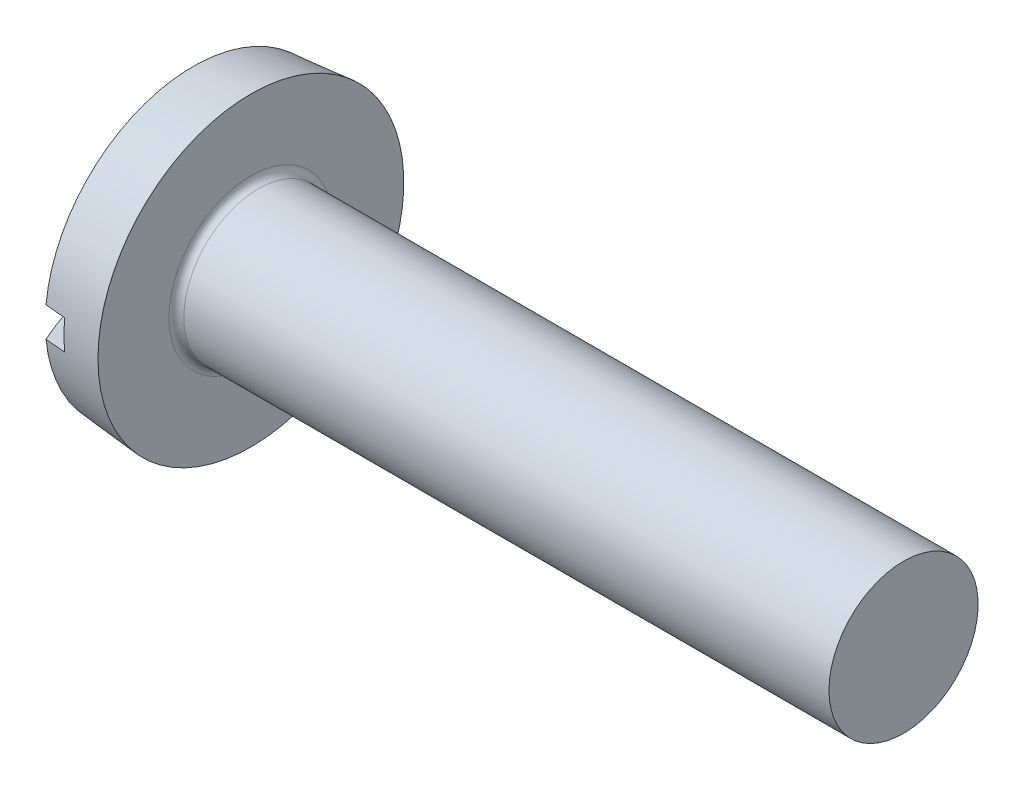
SolidWorks part; units mm, degrees
ref_plane "Plane1" through (0, 0, 0) normal (0, 0, 1) x (1, 0, 0)
ref_plane "Plane2" through (0, 0, 0) normal (0, 1, 0) x (1, 0, 0)
ref_plane "Plane3" through (0, 0, 0) normal (1, 0, 0) x (0, 0, -1)
other "Configuration Table"
sketch "BodySke" plane through (0, 0, 0) normal (0, 0, 1) x (1, 0, 0)
  line L0 (4.8, 4) -> (4.8, 8.2)
  line L1 (4.8, 8.2) -> (4.79, 8.2)
  line L2 (-25.4, 0) -> (127, 0) construction
  line L4 (4.8, 4) -> (39.8, 4)
  line L5 (39.8, 4) -> (39.8, 0)
  line L6 (39.8, 0) -> (0, 0)
  line L7 (4.8, -4) -> (39.8, -4) construction
  line L8 (6.05, 6.35) -> (6.05, -3.175) construction
  line L9 (9.8, 6.35) -> (9.8, -3.175) construction
  line L10 (4.79, 8.2) -> (1.7, 7.9297)
  arc A0 (0, 0) -> (1.7, 7.9297) centre (19.344, 0) cw
revolve "Base-Revolve" add sketch "BodySke"
fillet "Fillet1" radius 0.4 1 edges at (4.8, 0, 4)
sketch "Sketch2" plane through (0, 0, 0) normal (1, 0, 0) x (0, 0, -1)
  line L0 (8.2, -0.8) -> (8.2, 0.8)
  line L1 (8.2, 0.8) -> (-8.2, 0.8)
  line L2 (-8.2, 0.8) -> (-8.2, -0.8)
  line L3 (-8.2, -0.8) -> (8.2, -0.8)
extrude "Slot" cut sketch "Sketch2" along normal blind 2.8
sketch "ThdSchSke" plane through (0, 0, 0) normal (0, 0, 1) x (1, 0, 0)
  line L0 (9.8, -3.3095) -> (9.3165, -4)
  line L1 (9.8, -3.3095) -> (10.2835, -4)
  line L2 (10.2835, -4) -> (10.2835, -5)
  line L3 (-3.175, 0) -> (5.1513, 0) construction
  line L5 (10.2835, -5) -> (9.3165, -5)
  line L6 (9.3165, -5) -> (9.3165, -4)
revolve "ThreadSchematic" [suppressed] cut sketch "ThdSchSke" angle 360 about L3
pattern_linear "ThdSchPat" [suppressed]
equation "' \"Diameter@BodySke\" = 8"
equation "' \"Length@BodySke\" = 35"
equation "' \"Head_dia@BodySke\" = 16.4"
equation "' \"Oval_ht@BodySke\" = 1.7"
equation "' \"Head_ht@BodySke\" = 4.8"
equation "' \"Thread_nom@BodySke\" =  30"
equation "' \"Thread_nom@BodySke\" = 30"
equation "' \"Head_ang@BodySke\" = 85"
equation "' \"Slot_width@Sketch2\" = 1.6"
equation "' \"Slot_depth@Slot\" = 2.8"
equation "' \"Thread_minor@ThreadCosmetic\" = 6.619"
equation "' \"Advance@BodySke\" = 1.25"
equation "\"D1@Sketch2\" = \"Head_dia@BodySke\""
equation "\"D2@Sketch2\" = \"D1@Sketch2\" / 2"
equation "\"D3@Sketch2\" = \"Slot_width@Sketch2\" / 2"
equation "\"Thread_length@ThreadCosmetic\" = ((sgn( (\"Length@BodySke\" - \"Advance@BodySke\" * 2 ) - \"Thread_nom@BodySke\" )-1)*( (\"Length@BodySke\" - \"Advance@BodySke\" * 2 ) - \"Thread_nom@BodySke\" ))/-2+ \"Thread_nom@"
equation "\"Thread_minor@ThdSchSke\" = \"Thread_minor@ThreadCosmetic\""
equation "\"Diameter@ThdSchSke\" = \"Diameter@BodySke\""
equation "\"Overcut@ThdSchSke\" = \"Diameter@BodySke\" * 1.25"
equation "\"Start@ThdSchSke\" = \"Head_ht@BodySke\" + \"Length@BodySke\" - \"Thread_length@ThreadCosmetic\"  '---Non-countersunk---"
equation "\"Num_threads@ThdSchPat\" = int( \"Thread_length@ThreadCosmetic\" / \"Advance@BodySke\" + 0.999 )  + 1"
equation "\"Advance@ThdSchPat\" = \"Thread_length@ThreadCosmetic\" /  (\"Num_threads@ThdSchPat\" - 1) 'relax it"
